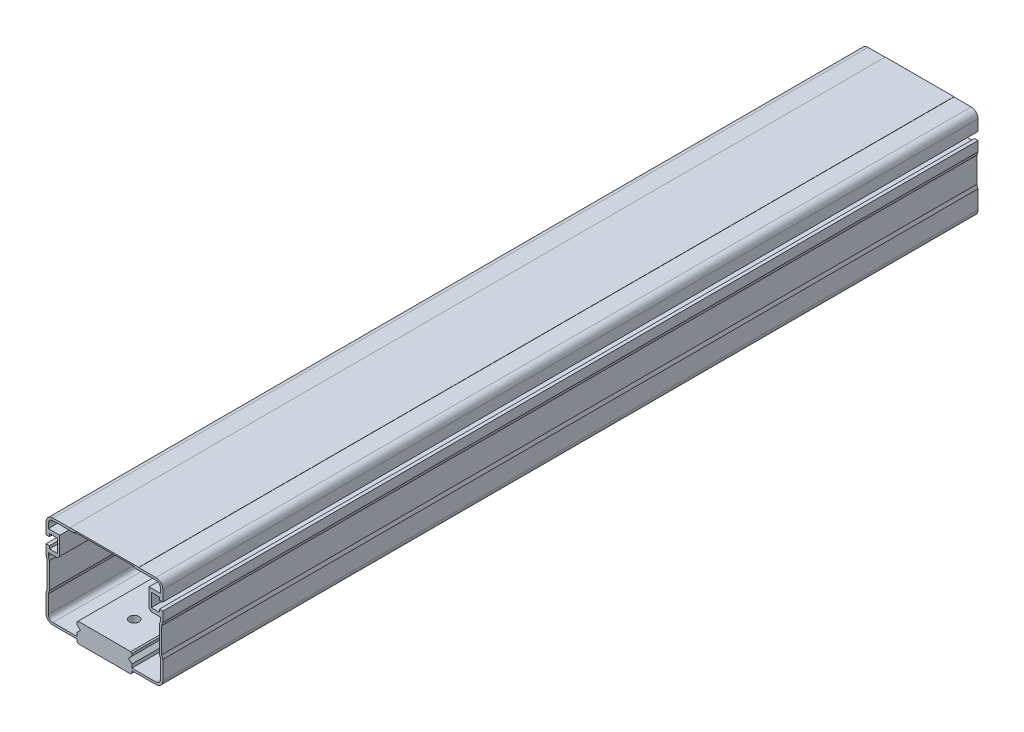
SolidWorks part; units mm, degrees
ref_plane "前视基准面" through (0, 0, 0) normal (0, 0, 1) x (1, 0, 0)
ref_plane "上视基准面" through (0, 0, 0) normal (0, 1, 0) x (1, 0, 0)
ref_plane "右视基准面" through (0, 0, 0) normal (1, 0, 0) x (0, 0, -1)
sketch "草图1" plane through (0, 0, 0) normal (0, 0, 1) x (1, 0, 0)
  line B0 (22.5, 42) -> (15, 42)
  line B1 (15, 42) -> (15, 42.1)
  line B2 (15, 42.1) -> (-15, 42.1)
  line B3 (-15, 42.1) -> (-15, 42)
  line B4 (-15, 42) -> (-22.5, 42)
  line B5 (-25.5, 39) -> (-25.5, 34.2)
  line B6 (-25.5, 34.2) -> (-24, 34.2)
  line B7 (-24, 34.2) -> (-24, 35.4)
  line B8 (-24, 35.4) -> (-20.5, 35.4)
  line B9 (-20.5, 35.4) -> (-20.5, 29.6)
  line B10 (-20.5, 29.6) -> (-24, 29.6)
  line B11 (-24, 29.6) -> (-24, 30.8)
  line B12 (-24, 30.8) -> (-25.5, 30.8)
  line B13 (-25.5, 30.8) -> (-25.5, 26.5)
  line B14 (-25.5, 26.5) -> (-25, 25)
  line B15 (-25, 25) -> (-25, 14)
  line B16 (-25, 14) -> (-25.5, 12.5)
  line B17 (-25.5, 12.5) -> (-25.5, 4.5)
  line B18 (-22.5, 1.5) -> (-12, 1.5)
  line B19 (-12, 1.5) -> (-12, 0.5)
  line B20 (-12, 0.5) -> (-11.5, 0)
  line B21 (-11.5, 0) -> (11.5, 0)
  line B22 (11.5, 0) -> (12, 0.5)
  line B23 (12, 0.5) -> (12, 1.5)
  line B24 (12, 1.5) -> (22.5, 1.5)
  line B25 (25.5, 4.5) -> (25.5, 12.5)
  line B26 (25.5, 12.5) -> (25, 14)
  line B27 (25, 14) -> (25, 25)
  line B28 (25, 25) -> (25.5, 26.5)
  line B29 (25.5, 26.5) -> (25.5, 30.8)
  line B30 (25.5, 30.8) -> (24, 30.8)
  line B31 (24, 30.8) -> (24, 29.6)
  line B32 (24, 29.6) -> (20.5, 29.6)
  line B33 (20.5, 29.6) -> (20.5, 35.4)
  line B34 (20.5, 35.4) -> (24, 35.4)
  line B35 (24, 35.4) -> (24, 34.2)
  line B36 (24, 34.2) -> (25.5, 34.2)
  line B37 (25.5, 34.2) -> (25.5, 39)
  line B38 (12, 2.5) -> (22.5, 2.5)
  line B39 (12, 4) -> (12, 2.5)
  line B40 (10.5, 5.5) -> (12, 4)
  line B41 (12, 7) -> (10.5, 5.5)
  line B42 (12, 8) -> (12, 7)
  line B43 (11.5, 8.5) -> (12, 8)
  line B44 (-11.5, 8.5) -> (11.5, 8.5)
  line B45 (-12, 8) -> (-11.5, 8.5)
  line B46 (-12, 7) -> (-12, 8)
  line B47 (-10.5, 5.5) -> (-12, 7)
  line B48 (-12, 4) -> (-10.5, 5.5)
  line B49 (-12, 2.5) -> (-12, 4)
  line B50 (-22.5, 2.5) -> (-12, 2.5)
  line B51 (-24.5, 12.3377) -> (-24.5, 4.5)
  line B52 (-24, 13.8377) -> (-24.5, 12.3377)
  line B53 (-24, 25.1623) -> (-24, 13.8377)
  line B54 (-24.5, 26.6623) -> (-24, 25.1623)
  line B55 (-24.5, 28) -> (-24.5, 26.6623)
  line B56 (-20.5, 28) -> (-24.5, 28)
  line B57 (-19.5, 29) -> (-20.5, 28)
  line B58 (-19.5, 37) -> (-19.5, 29)
  line B59 (-24.5, 37) -> (-19.5, 37)
  line B60 (-24.5, 39) -> (-24.5, 37)
  line B61 (-13, 41) -> (-22.5, 41)
  line B62 (-13, 41.5) -> (-13, 41)
  line B63 (13, 41.5) -> (-13, 41.5)
  line B64 (13, 41) -> (13, 41.5)
  line B65 (22.5, 41) -> (13, 41)
  line B66 (24.5, 37) -> (24.5, 39)
  line B67 (19.5, 37) -> (24.5, 37)
  line B68 (19.5, 29) -> (19.5, 37)
  line B69 (20.5, 28) -> (19.5, 29)
  line B70 (24.5, 28) -> (20.5, 28)
  line B71 (24.5, 26.6623) -> (24.5, 28)
  line B72 (24, 25.1623) -> (24.5, 26.6623)
  line B73 (24, 13.8377) -> (24, 25.1623)
  line B74 (24.5, 12.3377) -> (24, 13.8377)
  line B75 (24.5, 4.5) -> (24.5, 12.3377)
  arc B76 (-22.5, 42) -> (-25.5, 39) centre (-22.5, 39) ccw
  arc B77 (-25.5, 4.5) -> (-22.5, 1.5) centre (-22.5, 4.5) ccw
  arc B78 (22.5, 1.5) -> (25.5, 4.5) centre (22.5, 4.5) ccw
  arc B79 (25.5, 39) -> (22.5, 42) centre (22.5, 39) ccw
  arc B80 (-24.5, 4.5) -> (-22.5, 2.5) centre (-22.5, 4.5) ccw
  arc B81 (-22.5, 41) -> (-24.5, 39) centre (-22.5, 39) ccw
  arc B82 (24.5, 39) -> (22.5, 41) centre (22.5, 39) ccw
  arc B83 (22.5, 2.5) -> (24.5, 4.5) centre (22.5, 4.5) ccw
sketch_block_instance "块3-1"
sketch_block "块3"
extrude "凸台-拉伸1" add sketch "草图1" along normal blind 356
hole_wizard "M5 螺纹孔2" positions "草图4" profile "草图5" tap size "M5" standard "GB"
sketch "草图4" plane through (0, 0, 0) normal (0, -1, 0) x (-1, 0, 0)
  line L0 (0, -518) -> (0, -1380.0153) construction
  line L3 (11.5, -356) -> (-11.5, -356) construction
  point P2 (0, -343)
  point P12 (0, -303)
  point P14 (0, -263)
  point P16 (0, -223)
  point P18 (0, -183)
  point P20 (0, -143)
  point P22 (0, -103)
  point P24 (0, -63)
  point P42 (0, -23)
  point P44 (0, 17)
  point P46 (0, 57)
  point P48 (0, 97)
  point P50 (0, 137)
  point P52 (0, 177)
  point P53 (0, 217)
  point P55 (0, 257)
  point P57 (0, 297)
  point P59 (0, 337)
  point P61 (0, 377)
  point P63 (0, 417)
  point P65 (0, 457)
  point P68 (0, 537)
  point P71 (0, 497)
  dimension "D1" = 13
  dimension "D2" = 40
  dimension "D3" = 40
  dimension "D4" = 40
  dimension "D5" = 40
  dimension "D6" = 40
  dimension "D7" = 40
  dimension "D8" = 40
  dimension "D9" = 40
  dimension "D10" = 40
  dimension "D11" = 40
  dimension "D12" = 40
  dimension "D13" = 40
  dimension "D14" = 40
  dimension "D15" = 40
  dimension "D16" = 40
  dimension "D17" = 40
  dimension "D18" = 40
  dimension "D19" = 40
  dimension "D20" = 40
  dimension "D21" = 40
  dimension "D22" = 40
  dimension "D23" = 40
sketch "草图5" plane through (0, 0, 343) normal (1, 0, 0) x (0, 0, -1)
  line L0 (0, 0) -> (0, 15.6618)
  line L1 (0, 15.6618) -> (2.1, 14.4)
  line L2 (2.1, 14.4) -> (2.1, 0)
  line L5 (2.1, 0) -> (0, 0)
  line L10 (0, 15.6618) -> (-2.1, 14.4) construction
  line L11 (0, -6.35) -> (0, 107.95) construction
  dimension "螺纹孔钻头直径" = 4.2
  dimension "螺纹孔钻头深度" = 14.4
  dimension "导头角度" = 118
